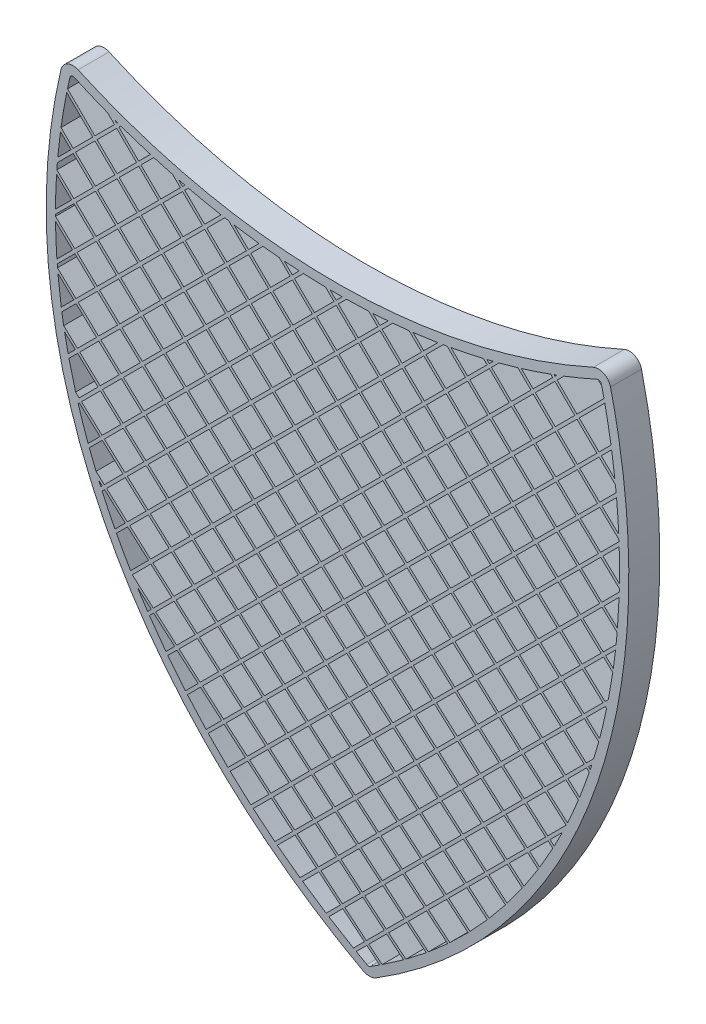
SolidWorks part; units mm, degrees
ref_plane "Front Plane" through (0, 0, 0) normal (0, 0, 1) x (1, 0, 0)
ref_plane "Top Plane" through (0, 0, 0) normal (0, 1, 0) x (1, 0, 0)
ref_plane "Right Plane" through (0, 0, 0) normal (1, 0, 0) x (0, 0, -1)
sketch "Sketch1" plane through (0, 0, 0) normal (0, 0, 1) x (1, 0, 0)
  line L0 (0, 0) -> (0, 200) construction
  line L1 (0, 200) -> (-34.6716, 200) construction
  arc A0 (0, 0) -> (-87.5, 220) centre (106.039, 169.5752) cw
  arc A1 (-87.5, 220) -> (87.5, 220) centre (0, 401.4063) ccw
  arc A2 (0, 0) -> (87.5, 220) centre (-106.039, 169.5752) ccw
  point P6 (-87.5, 219.9164)
  point P10 (87.5, 223.0887)
  point P11 (87.5, 213.043)
  dimension "D1" = 20
  dimension "D4" = 200
  dimension "D2" = 175
  dimension "D3" = 200
extrude "Boss-Extrude1" add sketch "Sketch1" along normal blind 50
shell "Shell1" thickness 3
ref_plane "Plane1" through (0, 0, 40) normal (0, 0, 1) x (1, 0, 0)
sketch "Sketch2" plane through (0, 0, 40) normal (0, 0, 1) x (1, 0, 0)
  line L0 (-87.5, 220) -> (-87.5, 253.3462) construction
  line L1 (-87.5, 220) -> (-61.052, 246.448) construction
  line L2 (-83.6062, 195.6096) -> (-73.4163, 205.7994)
  line L3 (-87.5, 220) -> (-115.1716, 247.6716) construction
  dimension "D1" = 45
  dimension "D2" = 20
rib "Rib1" sketch "Sketch2" sketch "Sketch2" thickness 1 extrusion direction normal to sketch draft on no parameters "D1"=1
pattern_linear "LPattern2" count 20 spacing 10 of "Rib1"
sketch "Sketch3" plane through (0, 0, 50) normal (0, 0, 1) x (1, 0, 0)
  line L0 (87.5, 220) -> (87.5, 240.7171) construction
  line L1 (87.5, 220) -> (68.5861, 238.9139) construction
  line L2 (73.5752, 205.6405) -> (81.5457, 197.67)
  point P6 (73.5752, 205.6405)
  dimension "D1" = 45
  dimension "D2" = 20
rib "Rib2" sketch "Sketch3" sketch "Sketch3" thickness 1 extrusion direction normal to sketch draft on no parameters "D1"=1
pattern_linear "LPattern3" count 20 spacing 10 along (-0.7071, -0.7071, 0) of "Rib2"
sketch "Sketch4" plane through (0, 0, 0) normal (1, 0, 0) x (0, 0, -1)
  line L0 (-50, 0) -> (0, 0) construction
  line L1 (-50, 220) -> (0, 220) construction
  line L2 (-25, 220) -> (-25, 232.9425) construction
  line L3 (-15, 220) -> (-15, 294.412) construction
  line L4 (-25, 220) -> (-15, 220)
  line L5 (-4, 0) -> (-14, 0)
  arc A0 (-14, 0) -> (-25, 220) centre (2180.5, 220) cw
  arc A1 (-4, 0) -> (-15, 220) centre (2190.5, 220) cw
  point P12 (-3.8039, 0)
  point P14 (-10, 0)
  dimension "D1" = 4
  dimension "D2" = 10
  dimension "D3" = 10
extrude "Cut-Extrude1" cut sketch "Sketch4" against normal through all both and the other way through all flip side to cut
fillet "Fillet1" radius 4 3 edges at (0, 0, 9) (87.5, 220, 20) (-87.5, 220, 20)
fillet "Fillet2" radius 1 3 edges at (0, 3.5489, 9.3529) (85.4778, 215.7306, 19.9959) (-85.4778, 215.7306, 19.9959)
